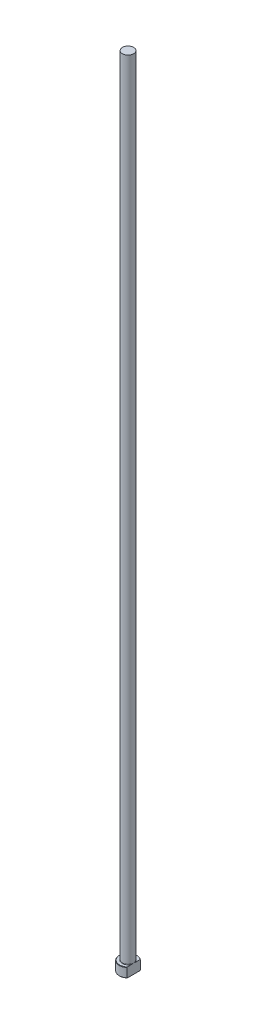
SolidWorks part; units mm, degrees
ref_plane "Front Plane" through (0, 0, 0) normal (0, 0, 1) x (1, 0, 0)
ref_plane "Top Plane" through (0, 0, 0) normal (0, 1, 0) x (1, 0, 0)
ref_plane "Right Plane" through (0, 0, 0) normal (1, 0, 0) x (0, 0, -1)
sketch "Sketch1" plane through (0, 0, 0) normal (0, 0, 1) x (1, 0, 0)
  line L0 (0, 259.9588) -> (0, -15.1925) construction
  line L1 (0, 0) -> (-5.5, 0)
  line L2 (-5.5, 0) -> (-5.5, 6)
  line L3 (-5.5, 6) -> (-3.5, 6)
  line L4 (-3.5, 6) -> (-3.5, 500)
  line L5 (-3.5, 500) -> (0, 500)
  line L6 (0, 500) -> (0, 0)
  dimension "L" = 500
  dimension "H" = 11
  dimension "T" = 6
  dimension "D" = 7
revolve "Revolve1" add sketch "Sketch1" angle 360 about L0
chamfer "Chamfer1" distance 0.2 angle 45 2 edges at (0, 6, 5.5) (0, 0, 5.5)
fillet "Fillet1" radius 0.2 1 edges at (0, 6, 3.5)
sketch "Sketch2" plane through (0, 0, 0) normal (0, 1, 0) x (1, 0, 0)
  line L0 (3.5, -4.2426) -> (3.5, 4.2426)
  circle A0 centre (0, 0) radius 5.5 construction
  arc A1 (3.5, -4.2426) -> (3.5, 4.2426) centre (0, 0) ccw
  circle A2 centre (0, 0) radius 3.5 construction
extrude "KEYED HEAD" cut sketch "Sketch2" along normal through all
